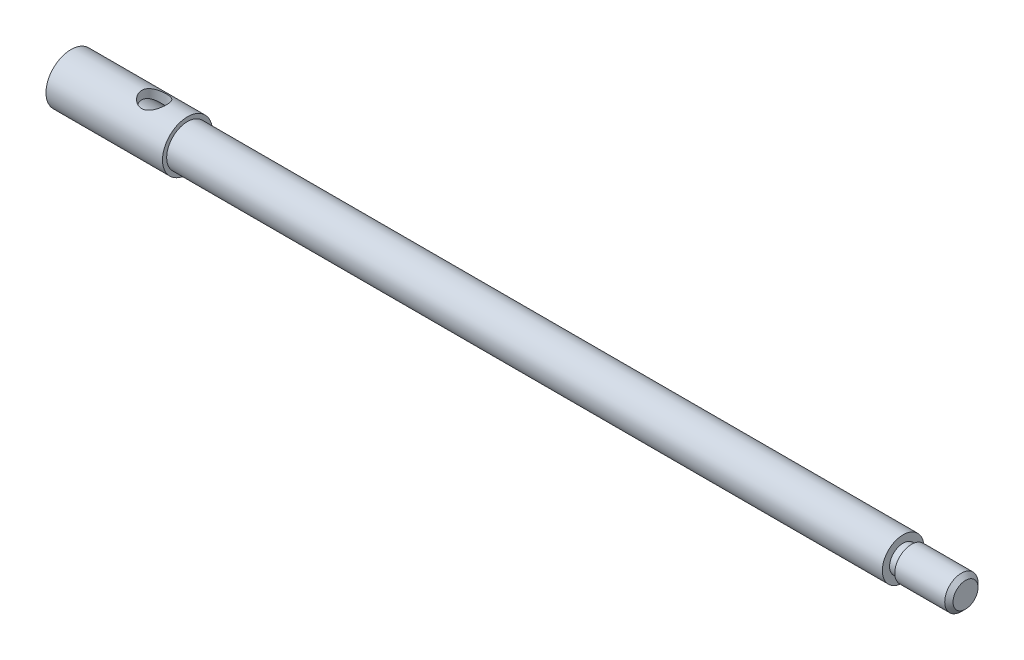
SolidWorks part; units mm, degrees
ref_plane "前视基准面" through (0, 0, 0) normal (0, 0, 1) x (1, 0, 0)
ref_plane "上视基准面" through (0, 0, 0) normal (0, 1, 0) x (1, 0, 0)
ref_plane "右视基准面" through (0, 0, 0) normal (1, 0, 0) x (0, 0, -1)
sketch "草图1" plane through (0, 0, 0) normal (0, 0, 1) x (1, 0, 0)
  line L0 (-123.4095, 0) -> (113.385, 0) construction
  line L1 (0, 150.3569) -> (0, -120.602) construction
  line L2 (-111.0396, 0) -> (-111.0396, 6)
  line L3 (-111.0396, 6) -> (-83.0396, 6)
  line L4 (-83.0396, 6) -> (-83.0396, 5)
  line L5 (-83.0396, 5) -> (88.9604, 5)
  line L6 (88.9604, 5) -> (88.9604, 3.25)
  line L7 (88.9604, 3.25) -> (90.9604, 3.25)
  line L8 (90.9604, 3.25) -> (90.9604, 4)
  line L9 (90.9604, 4) -> (103.9604, 4)
  line L10 (103.9604, 4) -> (103.9604, 0)
  line L11 (-111.0396, 0) -> (103.9604, 0)
  dimension "D1" = 215
  dimension "D2" = 3.25
  dimension "D3" = 28
  dimension "D4" = 5
  dimension "D5" = 6
  dimension "D6" = 4
  dimension "D7" = 13
  dimension "D8" = 2
revolve "旋转1" add sketch "草图1" angle 360 about L11
hole_wizard "孔1" positions "草图2" profile "草图4" legacy
sketch "草图2" plane through (-111.0396, 0, 0) normal (-1, 0, 0) x (0, 0, 1)
  point P0 (0, 0)
sketch "草图4" plane through (-111.0396, 0, 0) normal (0, 1, 0) x (0, 0, 1)
  line L0 (0, 0) -> (0, 27.4034)
  line L1 (0, 27.4034) -> (4, 25)
  line L2 (4, 25) -> (4, 0)
  line L4 (4, 0) -> (0, 0)
  line L6 (0, 27.4034) -> (-4, 25) construction
  line L7 (0, -4.2442) -> (0, 117.3081) construction
  dimension "直径" = 8
  dimension "深度" = 25
  dimension "导头角度" = 118
sketch "草图5" plane through (0, 0, 0) normal (0, 1, 0) x (1, 0, 0)
  line L0 (-111.0396, 6) -> (-111.0396, -6) construction
  circle A0 centre (-91.0396, 0) radius 3
  dimension "D2" = 6
  dimension "D1" = 20
extrude "切除-拉伸1" cut sketch "草图5" against normal through all both and the other way through all
chamfer "倒角1" distance 1 angle 45 1 edges at (103.9604, 0, 4)
